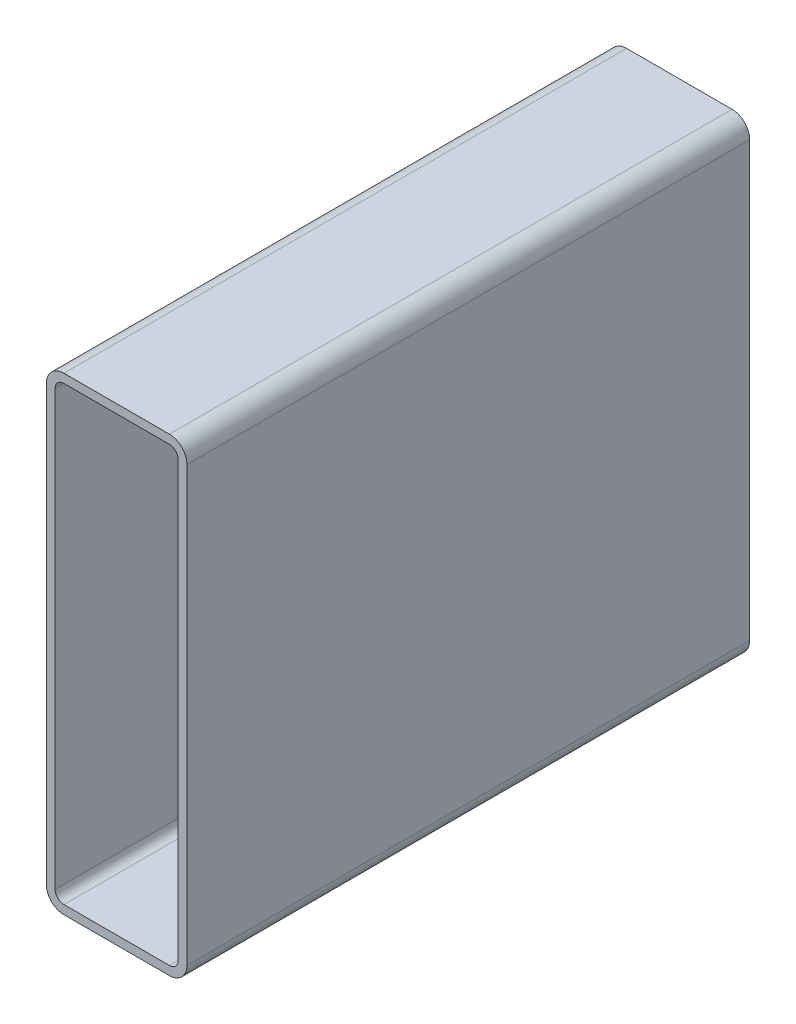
SolidWorks part; units mm, degrees
ref_plane "Front Plane" through (0, 0, 0) normal (0, 0, 1) x (1, 0, 0)
ref_plane "Top Plane" through (0, 0, 0) normal (0, 1, 0) x (1, 0, 0)
ref_plane "Right Plane" through (0, 0, 0) normal (1, 0, 0) x (0, 0, -1)
sketch "Sketch1" plane through (0, 0, 0) normal (0, 0, 1) x (1, 0, 0)
sketch_block_instance "HSS10x3x0.1875-1"
sketch_block "HSS10x3x0.1875"
extrude "Boss-Extrude1" add sketch "Sketch1" along normal blind 304.8
